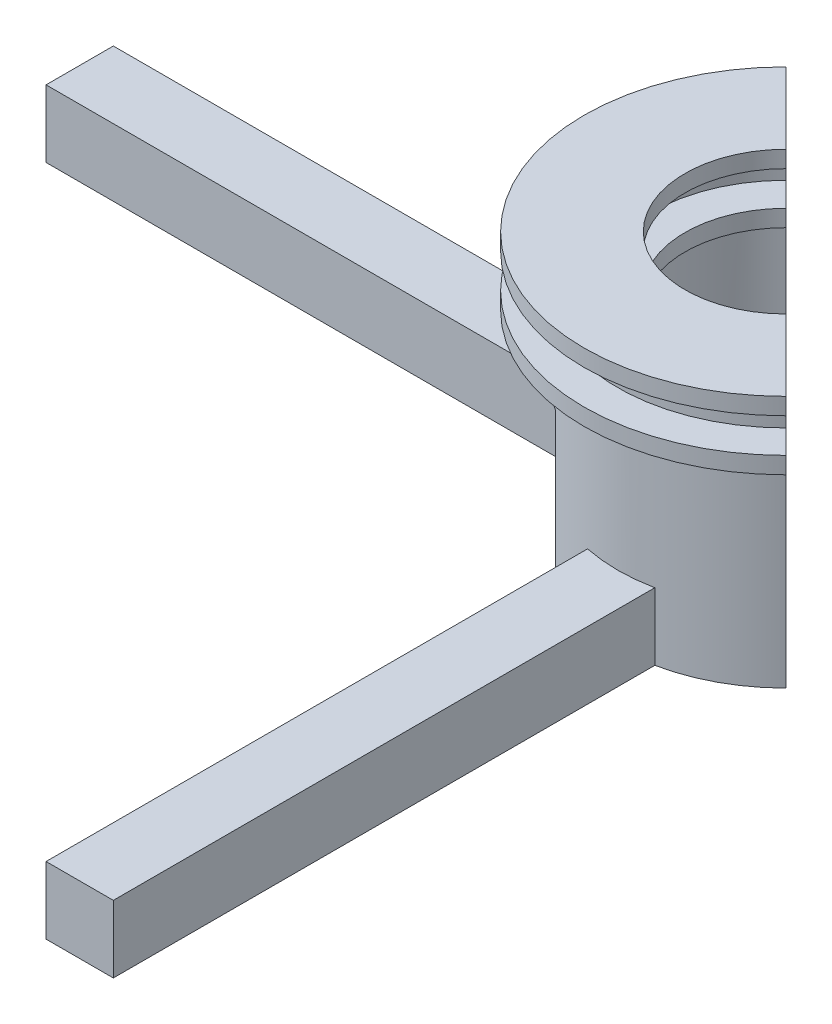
SolidWorks part; units mm, degrees
ref_plane "Front Plane" through (0, 0, 0) normal (0, 0, 1) x (1, 0, 0)
ref_plane "Top Plane" through (0, 0, 0) normal (0, 1, 0) x (1, 0, 0)
ref_plane "Right Plane" through (0, 0, 0) normal (1, 0, 0) x (0, 0, -1)
sketch "Sketch1" plane through (0, 0, 0) normal (0, 0, 1) x (1, 0, 0)
  line L0 (-15, 0) -> (0, 0) construction
  line L1 (-15, 0) -> (-15, -2.5)
  line L2 (-15, -2.5) -> (-20.1, -2.5)
  line L3 (-20.1, -2.5) -> (-20.1, -7.6)
  line L4 (-20.1, -7.6) -> (-15, -7.6)
  line L6 (-15, 0) -> (-25, 0)
  line L7 (-25, 0) -> (-25, -41.1)
  line L9 (-15, -7.6) -> (-15, -10.1)
  line L10 (-15, -10.1) -> (-20, -10.1)
  line L11 (-20, -10.1) -> (-20, -41.1)
  line L12 (-20, -41.1) -> (-25, -41.1)
  line L13 (0, 0) -> (0, -30) construction
  line L14 (-25, 0) -> (-30, 0)
  line L15 (-30, 0) -> (-30, -2.5)
  line L16 (-30, -2.5) -> (-25, -2.5)
  line L17 (-20.1, -7.6) -> (-25, -7.6) construction
  line L18 (-20.1, -2.5) -> (-25, -2.5) construction
  line L19 (-25, -7.6) -> (-30, -7.6)
  line L20 (-30, -7.6) -> (-30, -10.1)
  line L21 (-30, -10.1) -> (-25, -10.1)
  dimension "D1" = 5.1
  dimension "D2" = 10
  dimension "D3" = 31
  dimension "D4" = 15
  dimension "D5" = 2.5
  dimension "D6" = 5
  dimension "D7" = 5
revolve "Revolve1" add sketch "Sketch1" angle 360 about L13
ref_plane "Plane1" through (0, 0, 25) normal (0, 0, 1) x (1, 0, 0)
sketch "Sketch2" plane through (0, 0, 25) normal (0, 0, 1) x (1, 0, 0)
  line L0 (-25, -41.1) -> (25, -41.1) construction
  line L1 (0, -41.1) -> (-5, -41.1)
  line L2 (-5, -41.1) -> (-5, -31.1)
  line L3 (-5, -31.1) -> (5, -31.1)
  line L4 (5, -31.1) -> (5, -41.1)
  line L5 (5, -41.1) -> (0, -41.1)
  dimension "D1" = 10
extrude "Boss-Extrude1" add sketch "Sketch2" along normal blind 80 and the other way up to surface
pattern_circular "CirPattern1" count 4 every 90 about axis through (0, 0, 0) along (0, 1, 0) of "Boss-Extrude1"
ref_plane "Plane2" through (-17.6777, 0, 17.6777) normal (-0.7071, 0, 0.7071) x (0, 1, 0)
sketch "Sketch3" plane through (-17.6777, 0, 17.6777) normal (-0.7071, 0, 0.7071) x (0, 1, 0)
  line L0 (-41.1, 0) -> (-41.1, 6.15)
  line L1 (-41.1, 13.785) -> (-41.1, -13.785) construction
  line L2 (-41.1, 6.15) -> (-18.6, 6.15)
  line L3 (-18.6, 6.15) -> (-18.6, -6.15)
  line L4 (-18.6, -6.15) -> (-41.1, -6.15)
  line L5 (-41.1, -6.15) -> (-41.1, 0)
  point P4 (-27.1717, 3.9431)
  dimension "D1" = 12.3
  dimension "D2" = 22.5
extrude "Cut-Extrude1" cut sketch "Sketch3" against normal through all
ref_plane "Plane3" through (17.6777, 0, 17.6777) normal (0.7071, 0, 0.7071) x (0, 1, 0)
sketch "Sketch4" plane through (17.6777, 0, 17.6777) normal (0.7071, 0, 0.7071) x (0, 1, 0)
  line L0 (-41.1, 0) -> (-41.1, 7.5)
  line L1 (-41.1, 13.785) -> (-41.1, -13.785) construction
  line L2 (-41.1, 7.5) -> (-26.1, 7.5)
  line L3 (-26.1, 7.5) -> (-26.1, -7.5)
  line L4 (-26.1, -7.5) -> (-41.1, -7.5)
  line L5 (-41.1, -7.5) -> (-41.1, 0)
  dimension "D1" = 15
extrude "Boss-Extrude3" add sketch "Sketch4" against normal up to vertex (6.4595 mm away) contours L2 L3 L4 L5 L0
sketch "Sketch10" plane through (0, -41.1, 0) normal (0, -1, 0) x (1, 0, 0)
  line L0 (11.5601, 22.1667) -> (22.1667, 11.5601) construction
  line L1 (22.1667, 11.5601) -> (22.981, 12.3744)
  line L2 (22.981, 12.3744) -> (12.3744, 22.981)
  line L3 (12.3744, 22.981) -> (11.5601, 22.1667)
  arc A0 (22.1667, 11.5601) -> (11.5601, 22.1667) centre (0, 0) ccw
extrude "Cut-Extrude3" cut sketch "Sketch10" against normal up to surface (15 mm away) contours A0 L2 M9 | A0 M7 M8
sketch "Sketch11" plane through (0, -41.1, 0) normal (0, -1, 0) x (1, 0, 0)
  line L0 (-17.8056, 9.1082) -> (9.1082, -17.8056)
  line L1 (9.1082, -17.8056) -> (17.8056, -9.1082)
  line L2 (17.8056, -9.1082) -> (-9.1082, 17.8056)
  line L3 (-9.1082, 17.8056) -> (-17.8056, 9.1082)
extrude "Cut-Extrude4" cut sketch "Sketch11" against normal up to surface (31 mm away)
ref_plane "Plane9" through (0, 0, 0) normal (-0.7071, 0, 0.7071) x (0.7071, 0, 0.7071)
sketch "Sketch12" plane through (0, 0, 0) normal (-0.7071, 0, 0.7071) x (0.7071, 0, 0.7071)
  line L1 (-86.607, 52.3026) -> (83.838, 52.3026)
  line L2 (-86.607, 52.3026) -> (-86.607, -55.0716)
  line L3 (-86.607, -55.0716) -> (83.838, -55.0716)
  line L4 (83.838, 52.3026) -> (83.838, -55.0716)
extrude "Cut-Extrude5" cut sketch "Sketch12" against normal through all
